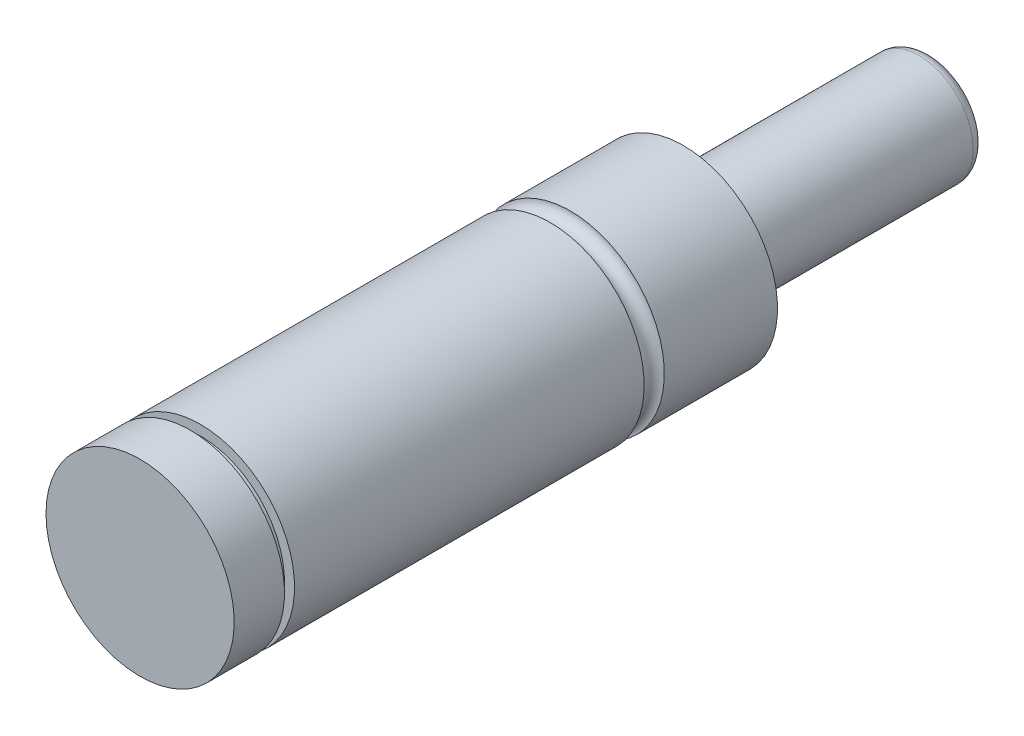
SolidWorks part; units mm, degrees
ref_plane "Front" through (0, 0, 0) normal (0, 0, 1) x (1, 0, 0)
ref_plane "Top" through (0, 0, 0) normal (0, 1, 0) x (1, 0, 0)
ref_plane "Right" through (0, 0, 0) normal (1, 0, 0) x (0, 0, -1)
sketch "Logo3_Revol_Axis" plane through (0, 0, 0) normal (0, 1, 0) x (1, 0, 0)
  line L0 (0, -30.1653) -> (0, 30.1653) construction
sketch "Logo3_bib1" plane through (0, 0, 0) normal (0, -1, 0) x (-1, 0, 0)
  line L0 (0, 79.8576) -> (0, 0)
  line L1 (0, 0) -> (9.4996, 0)
  line L2 (9.4996, 0) -> (9.4996, 5.08)
  line L3 (5.461, 54.864) -> (9.4996, 54.864)
  line L4 (5.461, 54.864) -> (5.461, 78.6638)
  line L5 (4.2672, 79.8576) -> (0, 79.8576)
  line L6 (9.4996, 5.08) -> (8.4836, 5.08)
  line L7 (8.4836, 5.08) -> (8.4836, 6.096)
  line L8 (8.4836, 6.096) -> (9.4996, 6.096)
  line L9 (9.4996, 6.096) -> (9.4996, 41.402)
  line L10 (0, 88.0738) -> (0, -34.1764) construction
  line L11 (7.6151, 42.418) -> (28.8972, 42.418) construction
  line L12 (8.4836, 52.4707) -> (8.4836, 42.083) construction
  line L13 (9.4996, 43.434) -> (9.4996, 54.864)
  line L14 (0, 54.9656) -> (5.461, 54.9656) construction
  arc A0 (9.4996, 43.434) -> (9.4996, 41.402) centre (9.4996, 42.418) ccw
  arc A1 (5.461, 78.6638) -> (4.2672, 79.8576) centre (4.2672, 78.6638) ccw
  dimension "logo3_r2b" = 1.016
  dimension "logo3_r0" = 1.1938
  dimension "logo3_d1" = 18.9992
  dimension "logo3_l1" = 79.8576
  dimension "logo3_l0" = 54.864
  dimension "logo3_d0" = 10.922
  dimension "logo3_l2" = 12.446
  dimension "logo3_r2" = 8.4836
  dimension "logo3_r3" = 8.4836
  dimension "logo3_l3" = 5.08
  dimension "logo3_th3" = 1.016
  dimension "logo3_fleche" = 24.892
revolve "Revolve1" add sketch "Logo3_bib1" angle 360 about L10
